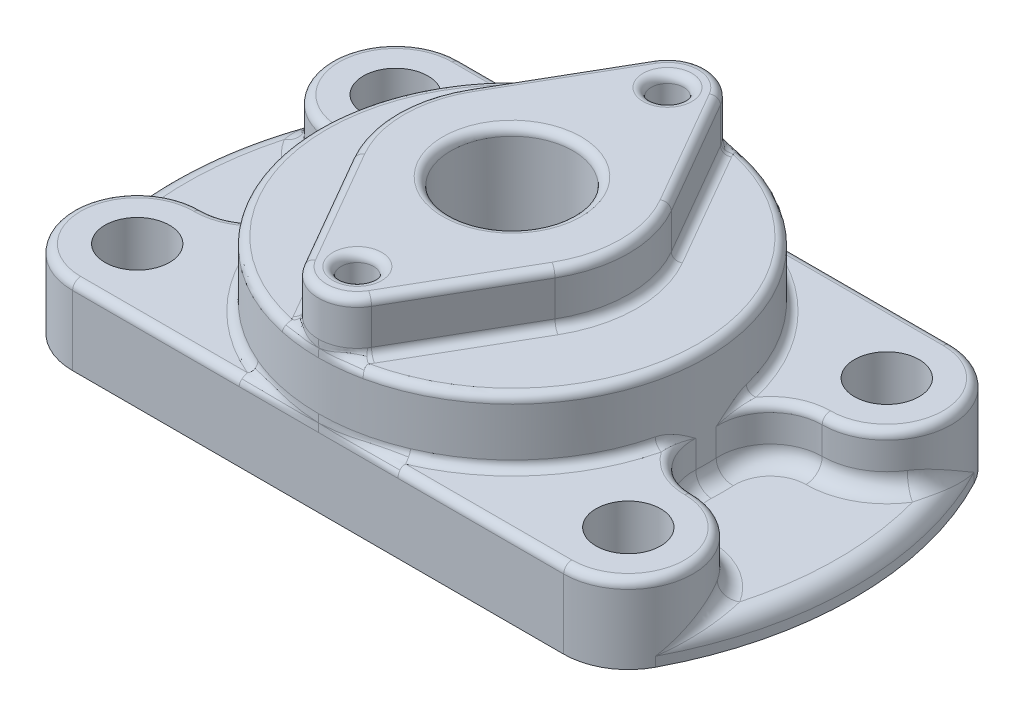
SolidWorks part; units mm, degrees
ref_plane "Front" through (0, 0, 0) normal (0, 0, 1) x (1, 0, 0)
ref_plane "Top" through (0, 0, 0) normal (0, 1, 0) x (1, 0, 0)
ref_plane "Right" through (0, 0, 0) normal (1, 0, 0) x (0, 0, -1)
sketch "Sketch1" plane through (0, 0, 0) normal (0, 1, 0) x (1, 0, 0)
  line L0 (-30, 16) -> (30, -16) construction
  line L1 (-30, 24) -> (30, 24)
  line L2 (-14.6169, 6.6316) -> (-6.6907, 21.3684)
  line L3 (-30, -24) -> (30, -24)
  line L4 (2.1163, 21.3684) -> (10.0425, 6.6316)
  line L5 (10.0425, -6.6316) -> (2.1163, -21.3684)
  line L6 (-6.6907, -21.3684) -> (-14.6169, -6.6316)
  arc A0 (-36.9282, 20) -> (-30, 24) centre (-30, 16) cw
  arc A1 (-30, -24) -> (-36.9282, -20) centre (-30, -16) cw
  arc A2 (36.9282, -20) -> (30, -24) centre (30, -16) cw
  arc A3 (36.9282, 20) -> (30, 24) centre (30, 16) ccw
  arc A4 (-36.9282, -20) -> (-36.9282, 20) centre (-2.2872, 0) cw
  arc A5 (36.9282, 20) -> (36.9282, -20) centre (2.2872, 0) cw
  circle A6 centre (-2.2872, 0) radius 24
  circle A7 centre (30, 16) radius 8
  circle A8 centre (30, -16) radius 8
  circle A9 centre (-30, -16) radius 8
  circle A10 centre (-30, 16) radius 8
  arc A11 (-31.2618, 8.1001) -> (-26.224, 1.7402) centre (-32.2082, 2.1752) cw
  arc A12 (-31.2618, -8.1001) -> (-26.224, -1.7402) centre (-32.2082, -2.1752) ccw
  arc A13 (28.6468, 8.1153) -> (21.6481, 1.7614) centre (27.6319, 2.2017) ccw
  arc A14 (28.6468, -8.1153) -> (21.6481, -1.7614) centre (27.6319, -2.2017) cw
  arc A15 (-6.6907, 21.3684) -> (2.1163, 21.3684) centre (-2.2872, 19) cw
  arc A16 (10.0425, 6.6316) -> (10.0425, -6.6316) centre (-2.2872, 0) cw
  arc A17 (2.1163, -21.3684) -> (-6.6907, -21.3684) centre (-2.2872, -19) cw
  arc A18 (-14.6169, -6.6316) -> (-14.6169, 6.6316) centre (-2.2872, 0) cw
  circle A19 centre (-2.2872, 19) radius 2.5
  circle A20 centre (-2.2872, -19) radius 2.5
  circle A21 centre (2.2872, 0) radius 7
  circle A22 centre (30, 16) radius 4
  circle A23 centre (30, -16) radius 4
  circle A24 centre (-30, 16) radius 4
  circle A25 centre (-30, -16) radius 4
  dimension "D1" = 8
  dimension "D2" = 60
  dimension "D3" = 40
  dimension "D4" = 32
  dimension "D5" = 6
  dimension "D6" = 5
  dimension "D7" = 14
  dimension "D8" = 5
  dimension "D9" = 14
  dimension "D10" = 8
sketch "Sketch2" plane through (0, 0, 0) normal (0, 1, 0) x (1, 0, 0)
  line L0 (-30.1625, 23.8125) -> (30.1625, 23.8125)
  line L1 (-30.1625, -23.8125) -> (30.1625, -23.8125)
  arc A0 (-37.1892, 19.5669) -> (-30.1625, 23.8125) centre (-30.1625, 15.875) cw
  arc A1 (-30.1625, -23.8125) -> (-37.1892, -19.5669) centre (-30.1625, -15.875) cw
  arc A2 (37.1892, -19.5669) -> (30.1625, -23.8125) centre (30.1625, -15.875) cw
  arc A3 (37.1892, 19.5669) -> (30.1625, 23.8125) centre (30.1625, 15.875) ccw
  arc A4 (-37.1892, -19.5669) -> (-37.1892, 19.5669) centre (0.0522, 0) cw
  arc A5 (37.1892, 19.5669) -> (37.1892, -19.5669) centre (-0.0522, 0) cw
extrude "Base-Extrude" add sketch "Sketch2" along normal blind 3.175
sketch "Sketch3" plane through (0, 0, 0) normal (0, 1, 0) x (1, 0, 0)
  line L0 (-30.1625, 23.8125) -> (30.1625, 23.8125)
  line L1 (-30.1625, -23.8125) -> (30.1625, -23.8125)
  arc A1 (30.1683, 7.9375) -> (30.1625, 23.8125) centre (30.1625, 15.875) ccw
  arc A2 (30.1625, -23.8125) -> (30.1683, -7.9375) centre (30.1625, -15.875) ccw
  arc A3 (-30.1103, -7.9377) -> (-30.1625, -23.8125) centre (-30.1625, -15.875) ccw
  arc A4 (-30.1625, 23.8125) -> (-30.1103, 7.9377) centre (-30.1625, 15.875) ccw
  arc A5 (-30.1103, 7.9377) -> (-23.7273, 1.2535) centre (-30.0685, 1.5878) cw
  arc A6 (-30.1103, -7.9377) -> (-23.7273, -1.2535) centre (-30.0685, -1.5878) ccw
  arc A7 (30.1683, 7.9375) -> (23.8317, 1.2533) centre (30.1729, 1.5875) ccw
  arc A8 (30.1683, -7.9375) -> (23.8317, -1.2533) centre (30.1729, -1.5875) cw
  arc A10 (23.8317, -1.2533) -> (23.8317, 1.2533) centre (0.0522, 0) ccw
  arc A11 (-23.7273, 1.2535) -> (-23.7273, -1.2535) centre (0.0522, 0) ccw
extrude "Boss-Extrude1" add sketch "Sketch3" along normal blind 9.525
sketch "Sketch4" plane through (0, 0, 0) normal (0, 1, 0) x (1, 0, 0)
  circle A0 centre (0.0522, 0) radius 23.8125
extrude "Boss-Extrude2" add sketch "Sketch4" along normal blind 17.4625
sketch "Sketch5" plane through (0, 0, 0) normal (0, 1, 0) x (1, 0, 0)
  line L0 (-12.3212, 7.1437) -> (-4.0723, 21.4312)
  line L1 (4.1766, 21.4312) -> (12.4255, 7.1437)
  line L2 (12.4255, -7.1438) -> (4.1766, -21.4313)
  line L3 (-4.0723, -21.4313) -> (-12.3212, -7.1438)
  arc A0 (-4.0723, 21.4312) -> (4.1766, 21.4312) centre (0.0522, 19.05) cw
  arc A1 (12.4255, 7.1437) -> (12.4255, -7.1438) centre (0.0522, 0) cw
  arc A2 (4.1766, -21.4313) -> (-4.0723, -21.4313) centre (0.0522, -19.05) cw
  arc A3 (-12.3212, -7.1438) -> (-12.3212, 7.1437) centre (0.0522, 0) cw
extrude "Boss-Extrude3" add sketch "Sketch5" along normal blind 23.8125
sketch "Sketch8" plane through (0, 0, 0) normal (0, 1, 0) x (1, 0, 0)
  circle A0 centre (-30.1625, -15.875) radius 3.9688
extrude "Cut-Extrude2" cut sketch "Sketch8" along normal through all
mirror "Mirror1" about plane through (0, 0, 0) normal (0, 0, 1) of "Cut-Extrude2"
mirror "Mirror2" about plane through (0, 0, 0) normal (1, 0, 0) of "Mirror1", "Cut-Extrude2"
hole_wizard "Ø15.0 (15) Diameter Hole1" positions "Sketch10" profile "Sketch9" hole size "Ø15.0" standard "Ansi Metric"
sketch "Sketch10" plane through (0, 23.8125, 0) normal (0, 1, 0) x (-1, 0, 0)
  point P0 (0, 0)
sketch "Sketch9" plane through (0, 23.8125, 0) normal (1, 0, 0) x (0, 0, 1)
  line L0 (0, 0) -> (0, 23.8125)
  line L1 (0, 23.8125) -> (7.5, 23.8125)
  line L2 (7.5, 23.8125) -> (7.5, 0)
  line L5 (7.5, 0) -> (0, 0)
  line L11 (0, -6.35) -> (0, 107.95) construction
  dimension "Thru Hole Dia." = 15
  dimension "Thru Hole Depth" = 23.8125
hole_wizard "Ø4.0 (4) Diameter Hole1" positions "Sketch12" profile "Sketch11" hole size "Ø4.0" standard "Ansi Metric"
sketch "Sketch12" plane through (0, 23.8125, 0) normal (0, 1, 0) x (-1, 0, 0)
  point P0 (-0.0522, -19.05)
  point P1 (-0.0522, 19.05)
sketch "Sketch11" plane through (0.0522, 23.8125, -19.05) normal (1, 0, 0) x (0, 0, 1)
  line L0 (0, 0) -> (0, 11.2017)
  line L1 (0, 11.2017) -> (2, 10)
  line L2 (2, 10) -> (2, 0)
  line L5 (2, 0) -> (0, 0)
  line L10 (0, 11.2017) -> (-2, 10) construction
  line L11 (0, -6.35) -> (0, 107.95) construction
  dimension "Hole Dia." = 4
  dimension "Hole Depth" = 10
  dimension "Drill Angle" = 118
fillet "Fillet2" radius 2 12 edges at (36.9577, 3.175, -11.7726) (-25.4761, 3.175, 5.9733) (42.0166, 3.175, 0) (-42.0166, 3.175, 0) (-36.9426, 3.175, 11.7478) (36.9577, 3.175, 11.7726) (-25.4761, 3.175, -5.9733) (-36.9426, 3.175, -11.7478) (25.5645, 3.175, -5.9562) (-23.7603, 3.175, 0) (25.5645, 3.175, 5.9562) (23.8647, 3.175, 0)
fillet "Fillet1" radius 1 41 edges at (-2.3291, 17.4625, 23.1744) (-8.1967, 17.4625, 14.2875) (2.4334, 17.4625, 23.1744) (8.3011, 17.4625, 14.2875) (14.3397, 17.4625, 0) (8.3011, 17.4625, -14.2875) (2.4334, 17.4625, -23.1744) (-14.2353, 17.4625, 0) (-2.3291, 17.4625, -23.1744) (-8.1967, 17.4625, -14.2875) (-16.3366, 9.525, -17.2755) (16.4411, 9.525, -17.2754) (-16.3366, 9.525, 17.2755) (16.4411, 9.525, 17.2754) (15.1073, 9.525, -23.8125) (-15.0552, 9.525, -23.8125) (38.1, 9.525, -15.8779) (25.5645, 9.525, -5.9562) (25.5645, 9.525, 5.9562) (38.1, 9.525, 15.8779) (-15.0552, 9.525, 23.8125) (15.1073, 9.525, 23.8125) (-38.1, 9.525, 15.8489) (-25.4761, 9.525, 5.9733) (-25.4761, 9.525, -5.9733) (-38.1, 9.525, -15.8489) (23.8647, 17.4625, 0) (-23.7603, 17.4625, 0) (-8.1967, 23.8125, -14.2875) (0.0522, 23.8125, -23.8125) (8.3011, 23.8125, -14.2875) (14.3397, 23.8125, 0) (8.3011, 23.8125, 14.2875) (0.0522, 23.8125, 23.8125) (-8.1967, 23.8125, 14.2875) (-14.2353, 23.8125, 0) (0, 23.8125, 7.5) (0.0522, 13.8125, 21.05) (0.0522, 23.8125, 21.05) (0.0522, 13.8125, -17.05) (0.0522, 23.8125, -17.05)
